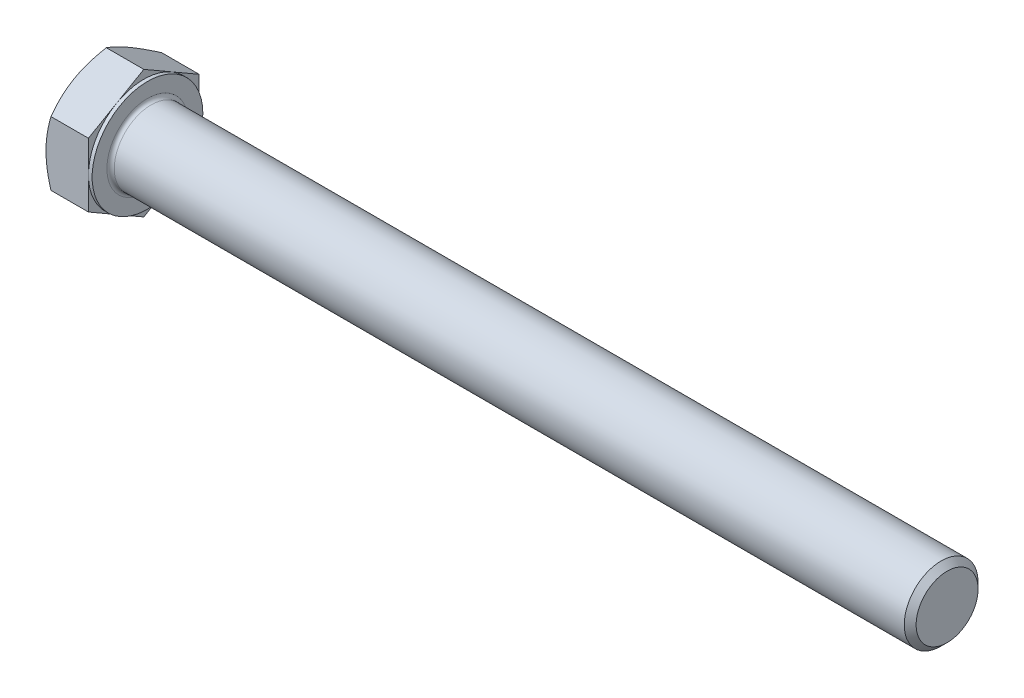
SolidWorks part; units mm, degrees
extrude "BaseHead" add sketch "Sketch1" along normal blind 7.5
sketch "Sketch1" plane through (0, 0, 0) normal (1, 0, 0) x (0, 0, -1)
  line L0 (9, 5.1962) -> (9, -5.1962)
  line L1 (-9, 5.1962) -> (-9, -5.1962)
  line L2 (9, -5.1962) -> (0, -10.3923)
  line L3 (0, -10.3923) -> (-9, -5.1962)
  line L4 (9, 5.1962) -> (0, 10.3923)
  line L5 (0, 10.3923) -> (-9, 5.1962)
revolve "HeadChamfer" cut sketch "Sketch3" angle 360 about L6
sketch "Sketch3" plane through (0, 0, 0) normal (0, 0, 1) x (1, 0, 0)
  line L0 (0, 9) -> (3.6906, 15.3923)
  line L1 (0, 10.3923) -> (0, 5.1962) construction
  line L2 (3.6906, 15.3923) -> (3.6906, 20.3923)
  line L3 (3.6906, 20.3923) -> (-10, 20.3923)
  line L4 (-10, 20.3923) -> (-10, 9)
  line L5 (-10, 9) -> (0, 9)
  line L6 (0, 0) -> (99.06, 0) construction
  line L7 (7.5, 10.3923) -> (0, 10.3923) construction
ref_plane "Plane1" through (0, 0, 0) normal (0, 0, 1) x (1, 0, 0)
ref_plane "Plane2" through (0, 0, 0) normal (0, 1, 0) x (1, 0, 0)
ref_plane "Plane3" through (0, 0, 0) normal (1, 0, 0) x (0, 0, -1)
sketch "BodySke" plane through (0, 0, 0) normal (0, 0, 1) x (1, 0, 0)
  line L0 (0, 5.1962) -> (0, -5.1962) construction
  line L1 (0, 0) -> (137.5, 0)
  line L2 (0, 0) -> (0, 6)
  line L3 (0, 6) -> (136.536, 6)
  line L4 (137.5, 0) -> (137.5, 5.036)
  line L5 (7.5, 10.3923) -> (7.5, 5.1962) construction
  line L6 (137.5, 5.036) -> (136.536, 6)
  line L7 (0, 0) -> (96.52, 0) construction
  line L8 (137.5, -5.036) -> (136.536, -6) construction
  line L9 (0, -6) -> (136.536, -6) construction
  line L10 (9.25, 15.24) -> (9.25, -1.27) construction
  line L11 (107.5, 15.24) -> (107.5, -1.27) construction
  line L12 (7.5, 5.1962) -> (7.5, -5.1962) construction
revolve "BaseBody" add sketch "BodySke"
fillet "HeadFillet" radius 0.6 1 edges at (7.5, 0, -6)
sketch "Sketch4" plane through (0, 0, 0) normal (0, 0, 1) x (1, 0, 0)
  line L1 (7.5, 10.3923) -> (7.5, 5.1962) construction
  line L2 (7.5, 9) -> (6.9, 9)
  line L3 (7.5, 9) -> (7.5, 20.3923)
  line L4 (7.5, 20.3923) -> (6.9, 20.3923)
  line L5 (0, 0) -> (95.25, 0) construction
  line L6 (0, 0) -> (96.52, 0) construction
  line L7 (6.9, 9) -> (6.9, 20.3923)
  line L8 (7.5, 10.3923) -> (0.8038, 10.3923) construction
revolve "BearingFace" cut sketch "Sketch4" angle 360 about L5
sketch "ThdSchSke" plane through (0, 0, 0) normal (0, 0, 1) x (1, 0, 0)
  line L0 (107.5, -5.036) -> (106.825, -6)
  line L1 (107.5, -5.036) -> (108.175, -6)
  line L2 (108.175, -6) -> (108.175, -7.5)
  line L3 (-3.175, 0) -> (5.1513, 0) construction
  line L5 (108.175, -7.5) -> (106.825, -7.5)
  line L6 (106.825, -7.5) -> (106.825, -6)
revolve "ThreadSchematic" [suppressed] cut sketch "ThdSchSke" angle 360 about L3
pattern_linear "ThdSchPat" [suppressed]
equation "\"D3@Sketch1\" = \"Width_flats@Sketch1\" / 2"
equation "\"D4@Sketch1\" = \"D3@Sketch1\""
equation "\"D5@Sketch1\" = \"D4@Sketch1\""
equation "\"Thread_minor@ThreadCosmetic\" = \"Minor_dia@BodySke\""
equation "\"D1@Sketch3\" = \"Width_flats@Sketch1\" / 2"
equation "\"D1@Sketch4\" = \"Width_flats@Sketch1\""
equation "\"Thread_length@ThreadCosmetic\" = ((sgn( (\"Length@BodySke\" - \"Advance@BodySke\" ) - \"Thread_nom@BodySke\" )-1)*( (\"Length@BodySke\" - \"Advance@BodySke\" ) - \"Thread_nom@BodySke\" ))/-2+ \"Thread_nom@BodySke\""
equation "\"Thread_minor@ThdSchSke\" = \"Minor_dia@BodySke\""
equation "\"Diameter@ThdSchSke\" = \"Diameter@BodySke\""
equation "\"Overcut@ThdSchSke\" = \"Diameter@BodySke\" * 1.25"
equation "\"Start@ThdSchSke\" = \"Head_ht@BaseHead\" + \"Length@BodySke\" - \"Thread_length@ThreadCosmetic\"  '---Non-countersunk---"
equation "\"Num_threads@ThdSchPat\" = int( \"Thread_length@ThreadCosmetic\" / \"Advance@BodySke\" + 0.999 )  + 1"
equation "\"Advance@ThdSchPat\" = \"Thread_length@ThreadCosmetic\" /  (\"Num_threads@ThdSchPat\" - 1) 'relax it"
equation "\"Num_threads@ThdSchPat\" = \"Num_threads@ThdSchPat\" - sgn( \"Num_threads@ThdSchPat\" - 1) '---chamfered tips only---"
